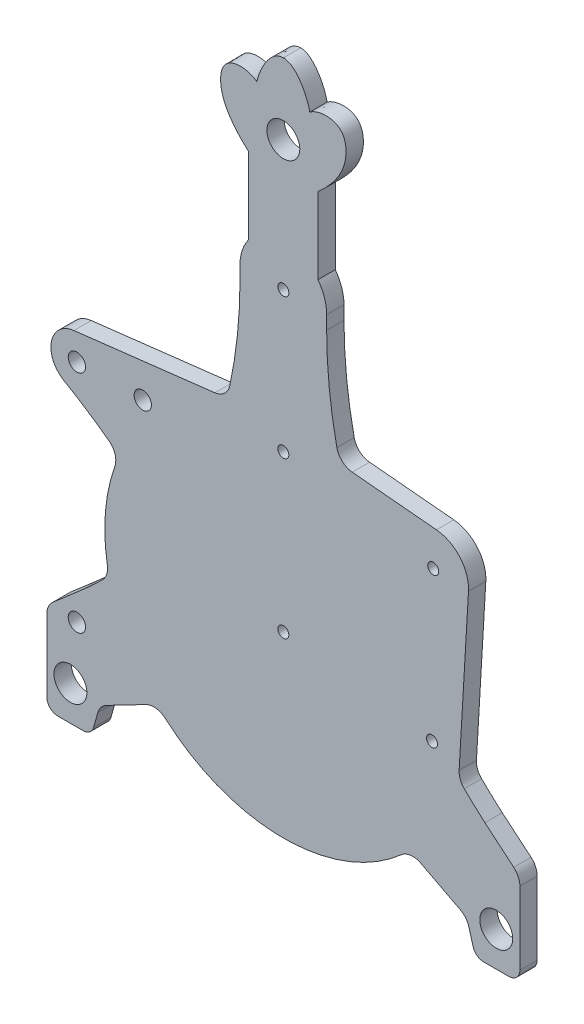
SolidWorks part; units mm, degrees
ref_plane "Спереди" through (0, 0, 0) normal (0, 0, 1) x (1, 0, 0)
ref_plane "Сверху" through (0, 0, 0) normal (0, 1, 0) x (1, 0, 0)
ref_plane "Справа" through (0, 0, 0) normal (1, 0, 0) x (0, 0, -1)
sketch "Эскиз1" plane through (0, 0, 0) normal (0, 0, 1) x (1, 0, 0)
  line L0 (-122.85, -87.13) -> (0, -87.13) construction
  line L1 (0, -87.13) -> (122.85, -87.13) construction
  line L2 (-130.15, -107.13) -> (-115.6025, -107.13)
  line L3 (115.6025, -107.13) -> (130.15, -107.13)
  line L4 (-136.5, -100.78) -> (-136.5, -59.2917)
  line L5 (136.5, -100.78) -> (136.5, -58.7923)
  line L6 (-136.5, -67.675) -> (0, -67.675) construction
  line L7 (0, -67.675) -> (136.5, -67.675) construction
  line L8 (-109.4924, -102.509) -> (-107.0546, -93.8939)
  line L9 (0, 423.5848) -> (0, -143.4551) construction
  line L10 (109.4924, -102.509) -> (107.0546, -93.8939)
  line L11 (-102.0344, -87.7385) -> (-79.3025, -75.9555)
  line L12 (102.0344, -87.7385) -> (79.3025, -75.9555)
  line L13 (-133.0606, -51.7446) -> (-116.3266, -37.198)
  line L14 (132.9289, -51.1327) -> (116.3266, -37.198)
  line L15 (36.186, 107.5671) -> (-45.1579, 107.5671) construction
  line L16 (-120.8691, 90.1777) -> (-39.5054, 99.7305)
  line L17 (-36.186, 0) -> (25, 0) construction
  line L18 (-133.0606, 51.7446) -> (-116.3266, 37.198) construction
  line L23 (101.4329, -18.4609) -> (106.8371, 73.7083)
  line L24 (39.7477, 99.705) -> (88.3745, 95.1941)
  line L25 (-13.1102, 246) -> (23.4638, 246) construction
  line L26 (-87.3301, 163.2) -> (639.8993, 163.2) construction
  line L27 (25, 216.6699) -> (25, 129.11) construction
  line L28 (25, 171) -> (25, 163.2)
  line L29 (-25, 171) -> (-25, 163.2)
  line L30 (20, 230.002) -> (20, 186)
  line L32 (-63.243, 286.87) -> (65.5796, 286.87) construction
  line L33 (1.1783, 286.87) -> (-1.2329, 286.87) construction
  line L34 (0, 286.87) -> (15.24, 286.87) construction
  line L35 (0, 286.87) -> (0, 267.326) construction
  line L36 (0, 267.326) -> (15.24, 267.326) construction
  line L37 (15.24, 286.87) -> (15.24, 267.326) construction
  line L38 (33.02, 280.1269) -> (33.02, 264.4046) construction
  line L39 (15.24, 230.002) -> (36.186, 230.002) construction
  line L40 (36.186, 276.4457) -> (36.186, 250.5137) construction
  line L41 (15.24, 267.326) -> (40.6715, 267.326) construction
  line L42 (-20, 230.002) -> (-20, 186)
  arc A0 (-68.0919, -77.3285) -> (68.0919, -77.3285) centre (0, 0) ccw
  circle A1 centre (-122.85, -87.13) radius 9.5
  circle A2 centre (122.85, -87.13) radius 9.5
  arc A3 (130.15, -107.13) -> (136.5, -100.78) centre (130.15, -100.78) ccw
  arc A4 (115.6025, -107.13) -> (109.4924, -102.509) centre (115.6025, -100.78) cw
  arc A5 (-109.4924, -102.509) -> (-115.6025, -107.13) centre (-115.6025, -100.78) cw
  arc A6 (-136.5, -100.78) -> (-130.15, -107.13) centre (-130.15, -100.78) ccw
  arc A7 (-30.8934, 107.5671) -> (-39.5054, 99.7305) centre (-40.6715, 109.6623) cw
  arc A8 (-102.0344, -87.7385) -> (-107.0546, -93.8939) centre (-97.4324, -96.6167) ccw
  arc A9 (-79.3025, -75.9555) -> (-68.0919, -77.3285) centre (-74.7005, -84.8336) cw
  arc A10 (102.0344, -87.7385) -> (107.0546, -93.8939) centre (97.4324, -96.6167) cw
  arc A11 (79.3025, -75.9555) -> (68.0919, -77.3285) centre (74.7005, -84.8336) ccw
  arc A12 (132.9289, -51.1327) -> (136.5, -58.7923) centre (126.5, -58.7923) cw
  arc A13 (104.4063, -26.1783) -> (101.4329, -18.4609) centre (111.4158, -19.0462) cw
  arc A14 (-101.5614, -17.3635) -> (-104.409, -26.1809) centre (-111.4184, -19.0488) cw
  arc A15 (-133.0606, -51.7446) -> (-136.5, -59.2917) centre (-126.5, -59.2917) ccw
  arc A16 (-20, 186) -> (-25, 171) centre (0, 171) ccw
  circle A17 centre (-119.12, -54.72) radius 5
  circle A18 centre (-119.12, 75.28) radius 5
  circle A19 centre (-81.12, 75.28) radius 5
  arc A20 (-120.8691, 90.1777) -> (-126.6091, 62.2833) centre (-119.12, 75.28) ccw
  arc A21 (-104.409, 26.1809) -> (-116.3266, 37.198) centre (-290.53, -163.2) ccw construction
  arc A22 (-101.5614, 17.3635) -> (-104.409, 26.1809) centre (-111.4184, 19.0488) ccw construction
  arc A23 (-97.2431, 34.0588) -> (-99.6715, 44.4965) centre (-106.6809, 37.3643) ccw
  arc A24 (-99.6715, 44.4965) -> (-126.6091, 62.2833) centre (-259.1808, -167.7839) ccw
  circle A25 centre (0, 0) radius 3.175
  circle A35 centre (0, 90) radius 3.175
  circle A36 centre (86.492, 74.9012) radius 3.175
  circle A37 centre (85.8065, -11.6961) radius 3.175
  arc A38 (106.8371, 73.7083) -> (88.3745, 95.1941) centre (86.492, 74.9012) ccw
  circle A41 centre (0, 171) radius 3.175
  circle A42 centre (0, 246) radius 9.5
  arc A43 (25, 163.2) -> (30.8934, 107.5671) centre (290.53, 163.2) ccw
  arc A44 (104.4063, -26.1783) -> (116.3266, -37.198) centre (290.53, 163.2) ccw
  arc A45 (25, 171) -> (20, 186) centre (0, 171) ccw
  arc A46 (-104.409, -26.1809) -> (-116.3266, -37.198) centre (-290.53, 163.2) cw
  arc A47 (30.8934, 107.5671) -> (39.7477, 99.705) centre (40.6715, 109.6623) ccw
  arc A48 (-25, 163.2) -> (-30.8934, 107.5671) centre (-290.53, 163.2) cw
  arc A49 (-97.2431, 34.0588) -> (-101.5614, -17.3635) centre (0, 0) ccw
  arc A50 (-97.2431, 34.0588) -> (101.4646, -17.9204) centre (0, 0) ccw construction
  spline S0 degree 3 poles (0, 286.87) (8.942, 286.87) (14.9128, 270.8257) (15.24, 267.326) knots 0 0 0 0 1 1 1 1
  spline S1 degree 3 poles (0, 286.87) (-8.942, 286.87) (-14.9128, 270.8257) (-15.24, 267.326) knots 0 0 0 0 1 1 1 1
  spline S2 degree 3 poles (15.24, 267.326) (19.1959, 270.4735) (28.3245, 271.6833) (35.5232, 265.0967) (38.2516, 249.0583) (27.773, 236.8661) (20, 230.002) knots 0 0 0 0 0.265881 0.312689 0.468082 1 1 1 1
  spline S3 degree 3 poles (-15.24, 267.326) (-19.1959, 270.4735) (-28.3245, 271.6833) (-35.5232, 265.0967) (-38.2516, 249.0583) (-27.773, 236.8661) (-20, 230.002) knots 0 0 0 0 0.265881 0.312689 0.468082 1 1 1 1
  point P21 (136.5, -54.13)
  point P25 (110.8, -107.13)
  point P28 (-110.8, -107.13)
  point P31 (-136.5, -107.13)
  point P34 (-105.8763, -89.73)
  point P38 (-105.8763, -89.73)
  point P41 (-73.0162, -72.6969)
  point P44 (105.8763, -89.73)
  point P47 (73.0162, -72.6969)
  point P53 (100.2677, -23.7194)
  point P56 (-100.2677, -23.7194)
  point P59 (-136.5, -54.13)
  point P60 (-136.5, -107.13)
  dimension "D1" = 206.07
  dimension "D2" = 19
  dimension "D9" = 6.35
  dimension "D12" = 10
  dimension "D15" = 10
  dimension "D20" = 75.28
  dimension "D21" = 81.12
  dimension "D23" = 6.35
  dimension "D35" = 40.76
  dimension "D37" = 10
  dimension "D42" = 19
  dimension "D46" = 531.06
  dimension "D13" = 10
  dimension "D48" = 10
  dimension "D16" = 10
  dimension "D49" = 103.035
  dimension "D17" = 10
  dimension "D24" = 30
  dimension "D3" = 245.7
  dimension "D4" = 107.13
  dimension "D5" = 20
  dimension "D6" = 273
  dimension "D7" = 15.8
  dimension "D8" = 25.7
  dimension "D10" = 27.4
  dimension "D11" = 17.4
  dimension "D14" = 53
  dimension "D18" = 54.72
  dimension "D19" = 119.12
  dimension "D22" = 38
  dimension "D32" = 90
  dimension "D33" = 86.6
  dimension "D34" = 87.8
  dimension "D38" = 5.3
  dimension "D41" = 81
  dimension "D43" = 156
  dimension "D44" = 86.492
  dimension "D45" = 73.2
  dimension "D47" = 25
  dimension "D50" = 20
  dimension "D51" = 394
  dimension "D52" = 15.24
  dimension "D53" = 19.544
  dimension "D54" = 17.78
  dimension "D55" = 37.324
  dimension "D56" = 36.186
extrude "Бобышка-Вытянуть1" add sketch "Эскиз1" along normal blind 10
